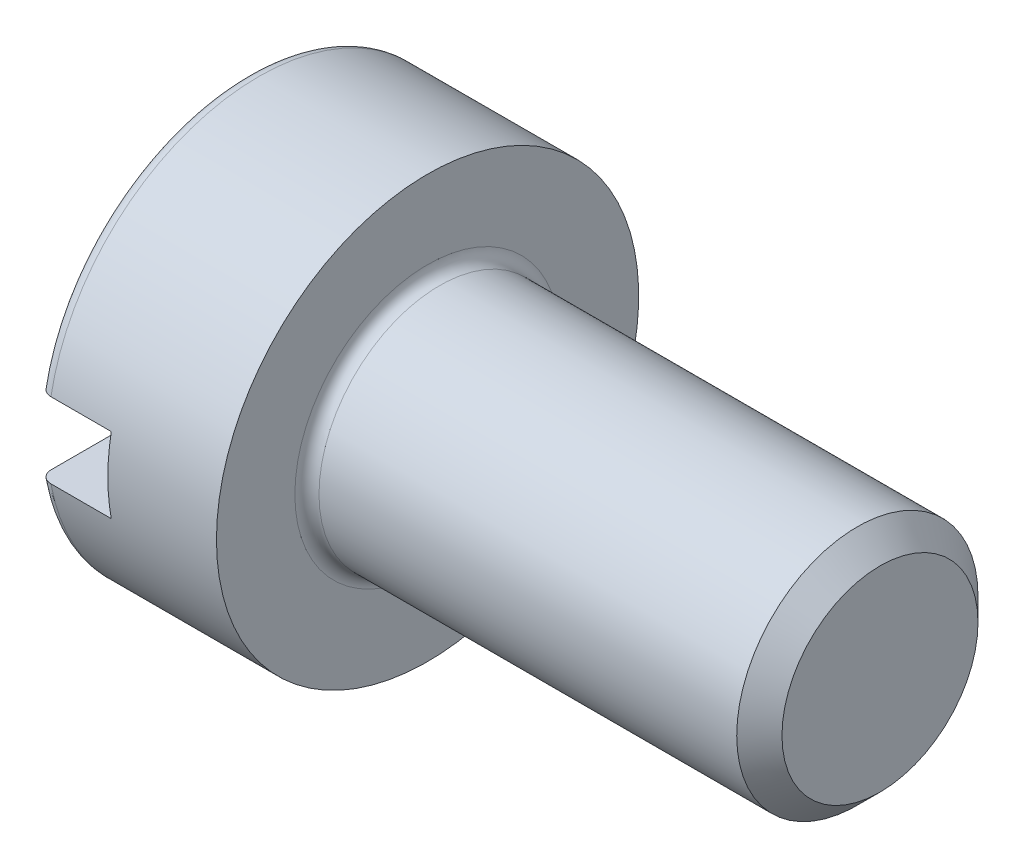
SolidWorks part; units mm, degrees
ref_plane "Plane1" through (0, 0, 0) normal (0, 0, 1) x (1, 0, 0)
ref_plane "Plane2" through (0, 0, 0) normal (0, 1, 0) x (1, 0, 0)
ref_plane "Plane3" through (0, 0, 0) normal (1, 0, 0) x (0, 0, -1)
sketch "BodySke" plane through (0, 0, 0) normal (0, 0, 1) x (1, 0, 0)
  line L0 (6, 4) -> (6, 7)
  line L1 (0, 0) -> (0, 7)
  line L2 (-25.4, 0) -> (127, 0) construction
  line L3 (21, 0) -> (0, 0)
  line L4 (6, 4) -> (21, 4)
  line L5 (21, 4) -> (21, 0)
  line L6 (0, 7) -> (6, 7)
  line L9 (7.5, 5.5875) -> (7.5, -3.9375) construction
  line L10 (6, 6.35) -> (6, -3.175) construction
  dimension "Head_ht" = 6
  dimension "Diameter" = 8
  dimension "Length" = 15
  dimension "Head_dia" = 14
  dimension "Advance" = 1.5
  dimension "Thread_nom" = 15
revolve "Base-Revolve" add sketch "BodySke" angle 360 about L2
fillet "Fillet1" radius 0.4 1 edges at (6, 0, 4)
fillet "Fillet2" radius 0.4 1 edges at (0, 0, 7)
sketch "Sketch2" plane through (0, 0, 0) normal (1, 0, 0) x (0, 0, -1)
  line L0 (8, -1.25) -> (-8, -1.25)
  line L1 (8, -1.25) -> (8, 1.25)
  line L2 (-8, 1.25) -> (8, 1.25)
  line L3 (-8, 1.25) -> (-8, -1.25)
  dimension "D1" = 16
  dimension "D2" = 8
  dimension "Slot_width" = 2.5
  dimension "D3" = 1.25
extrude "Slot" cut sketch "Sketch2" along normal blind 2.4
chamfer "Chamfer1" distance 0.75 angle 45 1 edges at (21, 0, 4)
